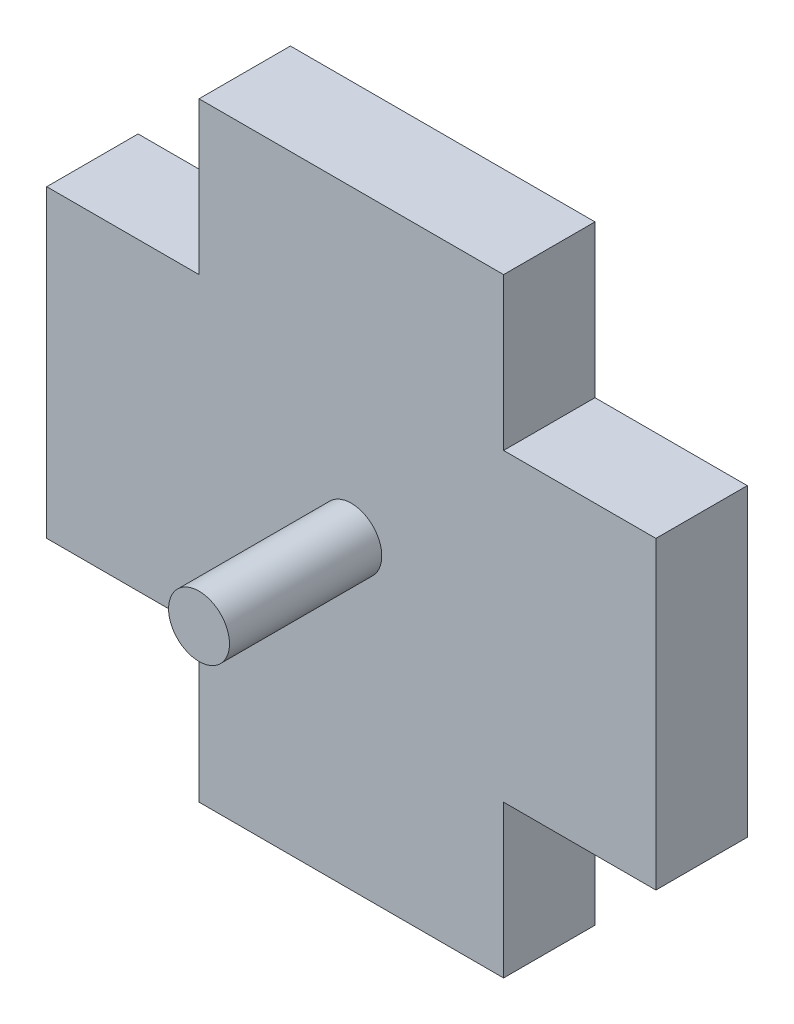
SolidWorks part; units mm, degrees
ref_plane "Front Plane" through (0, 0, 0) normal (0, 0, 1) x (1, 0, 0)
ref_plane "Top Plane" through (0, 0, 0) normal (0, 1, 0) x (1, 0, 0)
ref_plane "Right Plane" through (0, 0, 0) normal (1, 0, 0) x (0, 0, -1)
sketch "Sketch1" plane through (0, 0, 0) normal (0, 0, 1) x (1, 0, 0)
  line L0 (-10, 5) -> (-5, 5)
  line L1 (-5, 5) -> (-5, 10)
  line L2 (-5, 10) -> (5, 10)
  line L3 (5, 10) -> (5, 5)
  line L4 (5, 5) -> (10, 5)
  line L5 (10, 5) -> (10, -5)
  line L6 (10, -5) -> (5, -5)
  line L7 (5, -5) -> (5, -10)
  line L8 (5, -10) -> (-5, -10)
  line L9 (-5, -10) -> (-5, -5)
  line L10 (-5, -5) -> (-10, -5)
  line L11 (-10, -5) -> (-10, 5)
  dimension "D1" = 5
  dimension "D2" = 10
  dimension "D3" = 5
  dimension "D4" = 5
extrude "Extrude1" add sketch "Sketch1" against normal blind 3
sketch "Sketch2" plane through (0, 0, 0) normal (0, 0, 1) x (1, 0, 0)
  circle A0 centre (0, 0) radius 1
  dimension "D1" = 2
extrude "Extrude2" add sketch "Sketch2" along normal blind 5
